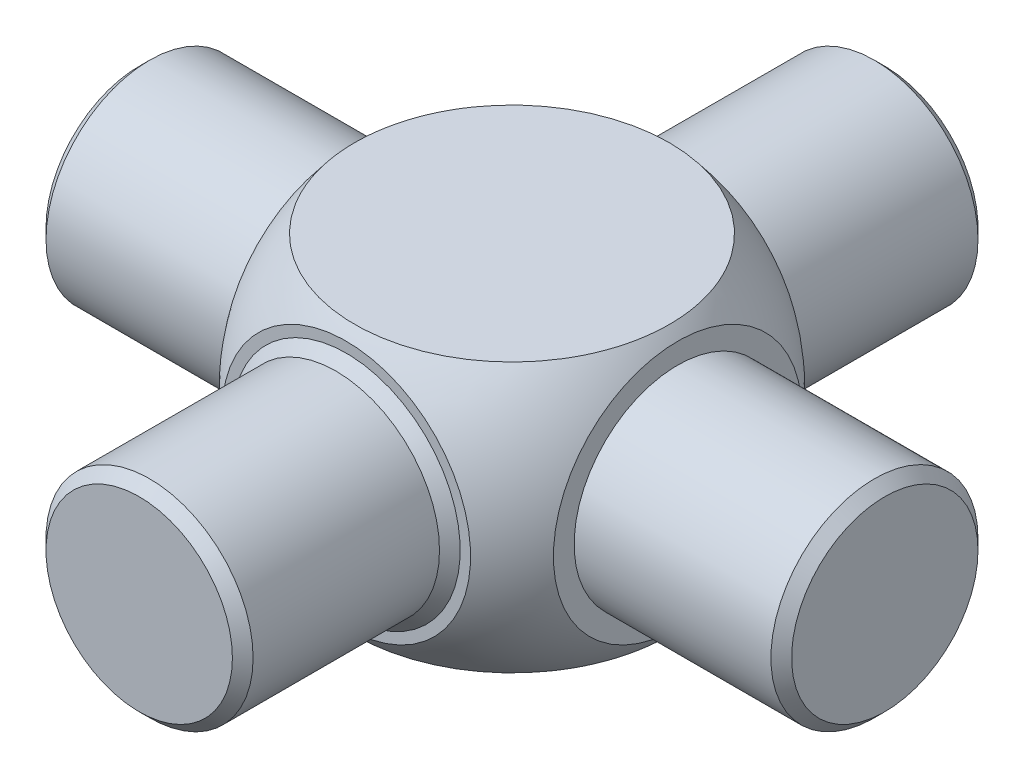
SolidWorks part; units mm, degrees
ref_plane "Plan1" through (0, 0, 0) normal (0, 0, 1) x (1, 0, 0)
ref_plane "Plan2" through (0, 0, 0) normal (0, 1, 0) x (1, 0, 0)
ref_plane "Plan3" through (0, 0, 0) normal (1, 0, 0) x (0, 0, -1)
sketch "Esquisse1" plane through (0, 0, 0) normal (0, 0, 1) x (1, 0, 0)
  line L0 (0, 0) -> (0, 43) construction
  line L1 (18, 0) -> (-18, 0)
  line L2 (18, 0) -> (18, 5)
  line L3 (18, 5) -> (8, 5)
  line L4 (-18, 0) -> (-18, 5)
  line L5 (-8, 5) -> (-18, 5)
  line L6 (0, 0) -> (-48, 0) construction
  line L7 (-8, 6) -> (-8, 5)
  line L8 (8, 6) -> (8, 5)
  arc A0 (8, 6) -> (-8, 6) centre (0, 0) ccw
  dimension "D2" = 20
  dimension "D1" = 36
  dimension "D3" = 5
  dimension "D4" = 8
revolve "Base-Révolution" add sketch "Esquisse1" angle 360 about L6
sketch "Esquisse2" plane through (0, 0, 0) normal (0, 0, 1) x (1, 0, 0)
  line L0 (0, 0) -> (7, 0) construction
  line L1 (9, 6.5) -> (-9, 6.5)
  line L2 (-9, -6.5) -> (-9, -11)
  line L3 (9, -11) -> (-9, -11)
  line L4 (9, -6.5) -> (9, -11)
  line L5 (9, -6.5) -> (-9, -6.5)
  line L7 (9, 6.5) -> (9, 11)
  line L8 (9, 11) -> (-9, 11)
  line L9 (-9, 6.5) -> (-9, 11)
  dimension "D1" = 6.5
extrude "Enlèv. mat.-Extru.1" cut sketch "Esquisse2" against normal mid plane 25
sketch "Esquisse3" plane through (0, 0, 0) normal (0, 1, 0) x (1, 0, 0)
  line L0 (0, 0) -> (-6, 0) construction
  line L1 (-9, 8) -> (9, 8)
  line L2 (-9, 8) -> (-9, 11)
  line L3 (-9, 11) -> (9, 11)
  line L4 (9, 8) -> (9, 11)
  line L5 (0, 0) -> (-48, 0) construction
  line L6 (9, -8) -> (9, -11)
  line L7 (-9, -11) -> (9, -11)
  line L8 (-9, -8) -> (-9, -11)
  line L9 (-9, -8) -> (9, -8)
  dimension "D1" = 8
extrude "Enlèv. mat.-Extru.2" cut sketch "Esquisse3" against normal mid plane 25
sketch "Esquisse4" plane through (0, 0, 0) normal (0, 1, 0) x (1, 0, 0)
  line L1 (0, 18) -> (0, -18)
  line L2 (0, -18) -> (5, -18)
  line L3 (0, 18) -> (5, 18)
  line L4 (5, -18) -> (5, 18)
  line L5 (0, 0) -> (9, 0) construction
  line L6 (0, 0) -> (0, 12) construction
  dimension "D1" = 36
revolve "Boss.-Révol.1" add sketch "Esquisse4" angle 360 about L6
chamfer "Chanfrein1" distance 0.5 angle 45
